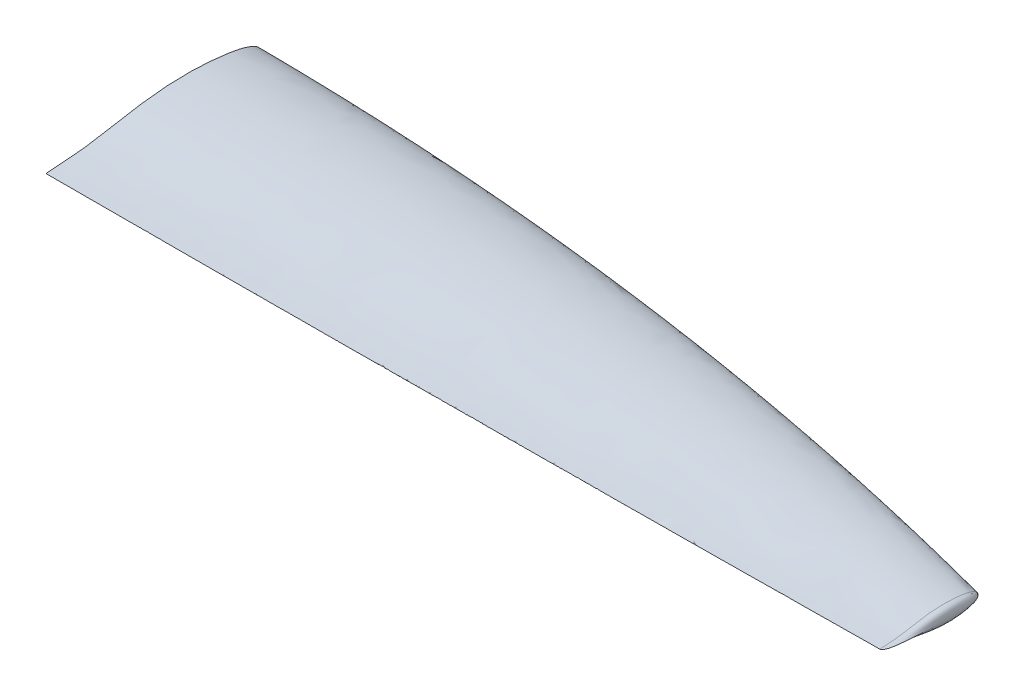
SolidWorks part; units mm, degrees
other "<Gouverne de profondeur gauche>-<Dome1>"
ref_plane "Front Plane" through (0, 0, 0) normal (0, 0, 1) x (1, 0, 0)
ref_plane "Top Plane" through (0, 0, 0) normal (0, 1, 0) x (1, 0, 0)
ref_plane "Right Plane" through (0, 0, 0) normal (1, 0, 0) x (0, 0, -1)
mirrored part "Gouverne de profondeur gauche_Symétrique"
sketch "Esquisse1" plane through (0, 0, 0) normal (0, 1, 0) x (1, 0, 0)
  line L0 (27.5, -163.4968) -> (1471.3634, -163.4968) construction
  line L1 (27.5, 196.1301) -> (27.5, -163.4968) construction
sketch "Esquisse2" plane through (0, 0, 0) normal (0, 1, 0) x (1, 0, 0)
  line L0 (27.5, 196.1301) -> (27.5, -163.4968) construction
  line L2 (27.5, -163.4968) -> (1471.3634, -163.4968) construction
  point P0 (597.5, 61.5032)
  point P5 (1452.0221, -163.4968)
  dimension "D1" = 570
  dimension "D2" = 225
